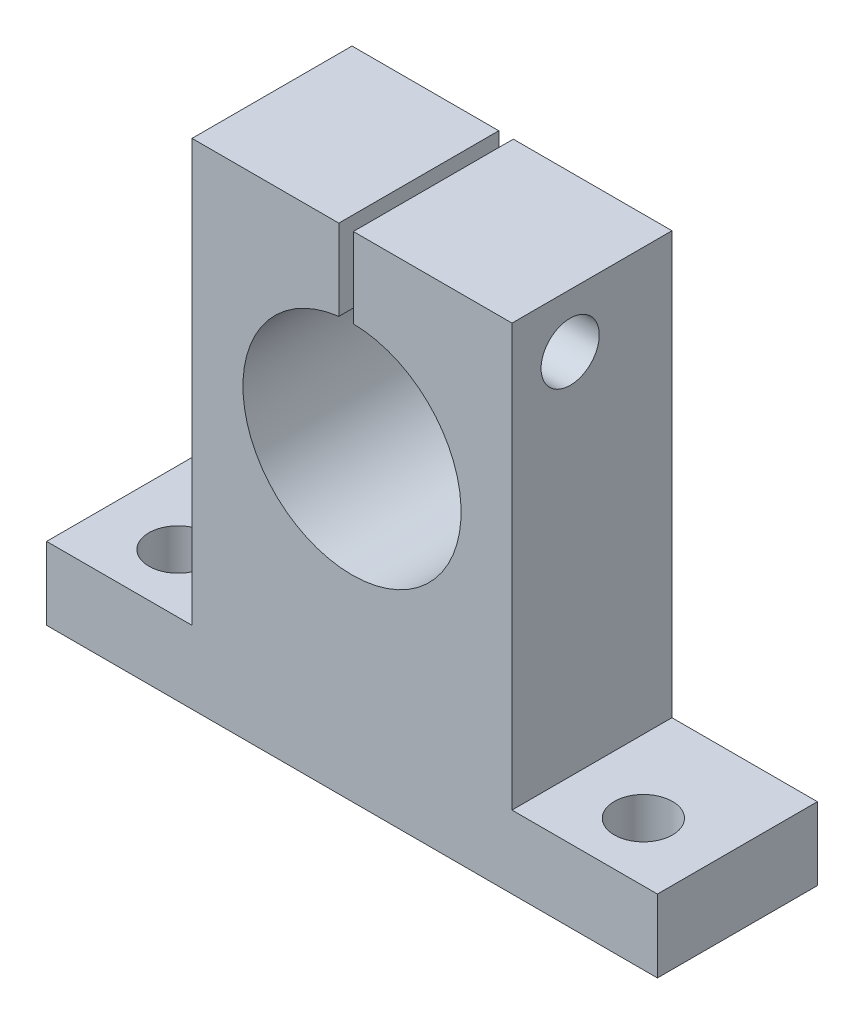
SolidWorks part; units mm, degrees
ref_plane "Front Plane" through (0, 0, 0) normal (0, 0, 1) x (1, 0, 0)
ref_plane "Top Plane" through (0, 0, 0) normal (0, 1, 0) x (1, 0, 0)
ref_plane "Right Plane" through (0, 0, 0) normal (1, 0, 0) x (0, 0, -1)
sketch "Sketch1" plane through (0, 0, 0) normal (0, 0, 1) x (1, 0, 0)
  line L0 (44.6812, 0.3547) -> (64.6812, 0.3547)
  line L1 (-19.3188, -9.6453) -> (64.6812, -9.6453)
  line L2 (-19.3188, -9.6453) -> (-19.3188, 0.3547)
  line L3 (-19.3188, 0.3547) -> (0.6812, 0.3547)
  line L4 (64.6812, -9.6453) -> (64.6812, 0.3547)
  line L8 (0.6812, 0.3547) -> (0.6812, 58.3547)
  line L9 (0.6812, 58.3547) -> (44.6812, 58.3547)
  line L10 (44.6812, 0.3547) -> (44.6812, 58.3547)
  point P0 (22.6812, -3.6453)
  point P9 (64.6812, -4.6453)
  dimension "D1" = 10
  dimension "D2" = 58
  dimension "D3" = 84
  dimension "D4" = 44
  dimension "D5" = 20
  dimension "D6" = 20
extrude "Boss-Extrude1" add sketch "Sketch1" along normal blind 22
sketch "Sketch2" plane through (0, 0, 22) normal (0, 0, 1) x (1, 0, 0)
  line L0 (-19.3188, -9.6453) -> (64.6812, -9.6453) construction
  line L1 (-19.3188, 0.3547) -> (-19.3188, -9.6453) construction
  line L2 (20.8654, 58.1616) -> (20.8654, 58.3547)
  line L3 (44.6812, 58.3547) -> (0.6812, 58.3547) construction
  line L4 (20.8654, 47.2444) -> (20.8654, 58.1616)
  line L5 (20.8654, 58.3547) -> (22.8654, 58.3547)
  line L6 (22.8654, 47.3536) -> (22.8654, 58.1616)
  line L7 (22.8654, 58.3547) -> (22.8654, 58.1616)
  arc A1 (20.8654, 47.2444) -> (22.8654, 47.3536) centre (22.6812, 32.3547) ccw
  point P6 (21.8654, 45.0478)
  dimension "D1" = 42
  dimension "D2" = 42
  dimension "D4" = 2
extrude "Cut-Extrude1" cut sketch "Sketch2" against normal through all contours A1 L6 L7 L5 L2 L4
sketch "Sketch3" plane through (0, 0.3547, 0) normal (0, 1, 0) x (1, 0, 0)
  line L0 (-19.3188, -22) -> (-19.3188, 0) construction
  line L1 (64.6812, -22) -> (64.6812, 0) construction
  point P0 (-9.3188, -13.9326)
  point P1 (54.6812, -13.9326)
  dimension "D1" = 10
  dimension "D2" = 10
hole_wizard "Ø8.0mm Dowel Slot1" positions "Sketch4" profile "Sketch5" size "Ø8.0" standard "ISO"
sketch "Sketch4" plane through (0, 0.3547, 0) normal (0, 1, 0) x (1, 0, 0)
  point P0 (-9.3188, -13.9326)
  point P3 (54.6812, -13.9326)
sketch "Sketch5" plane through (-9.3188, 0.3547, 13.9326) normal (1, 0, 0) x (0, 0, 1)
  line L0 (0, 0) -> (0, 22.4034)
  line L1 (0, 22.4034) -> (4, 20)
  line L2 (4, 20) -> (4, 0)
  line L5 (4, 0) -> (0, 0)
  line L10 (0, 22.4034) -> (-4, 20) construction
  line L11 (0, -6.35) -> (0, 107.95) construction
  dimension "Hole Dia." = 8
  dimension "Hole Depth" = 20
  dimension "Drill Angle" = 118
sketch "Sketch6" plane through (0.6812, 0, 0) normal (-1, 0, 0) x (0, 0, 1)
  line L0 (0, 58.3547) -> (0, 0.3547) construction
  line L1 (22, 58.3547) -> (0, 58.3547) construction
  point P0 (14, 50.9385)
  point P5 (11, 58.3547)
  dimension "D1" = 14
  dimension "D2" = 8
hole_wizard "Ø8.0mm Dowel Slot2" positions "Sketch7" profile "Sketch8" size "Ø8.0" standard "ISO"
sketch "Sketch7" plane through (0.6812, 0, 0) normal (-1, 0, 0) x (0, 0, 1)
  point P0 (14, 50.9385)
sketch "Sketch8" plane through (0.6812, 50.9385, 14) normal (0, 1, 0) x (0, 0, 1)
  line L0 (0, 0) -> (0, 52.4034)
  line L1 (0, 52.4034) -> (4, 50)
  line L2 (4, 50) -> (4, 0)
  line L5 (4, 0) -> (0, 0)
  line L10 (0, 52.4034) -> (-4, 50) construction
  line L11 (0, -6.35) -> (0, 107.95) construction
  dimension "Hole Dia." = 8
  dimension "Hole Depth" = 50
  dimension "Drill Angle" = 118
